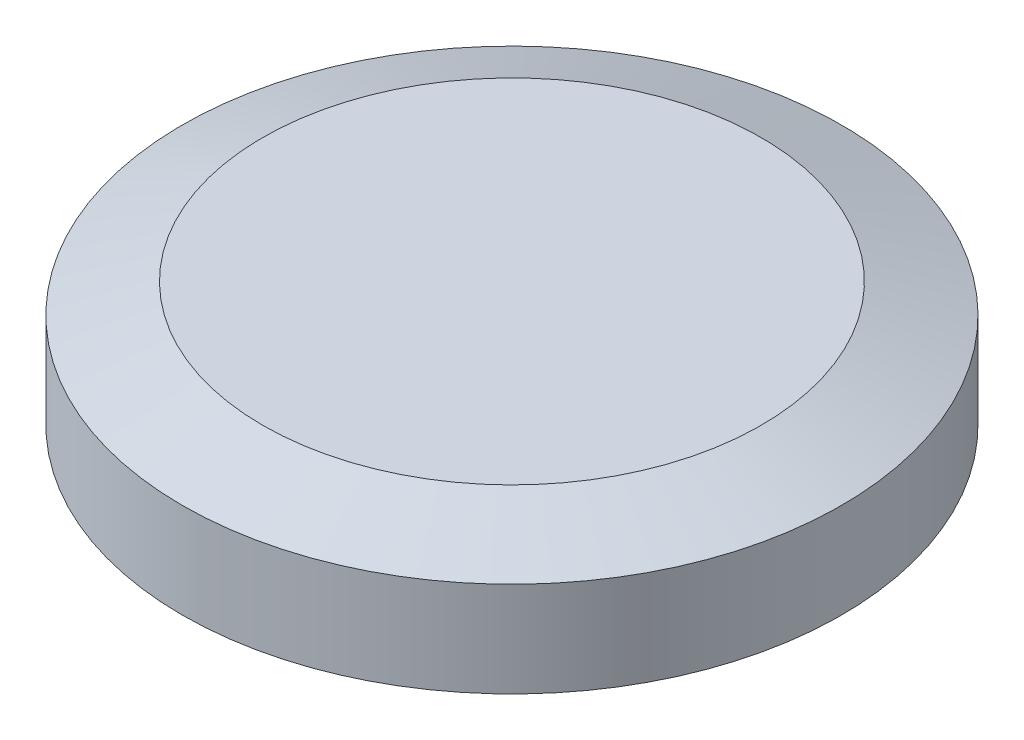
SolidWorks part; units mm, degrees
ref_plane "Front Plane" through (0, 0, 0) normal (0, 0, 1) x (1, 0, 0)
ref_plane "Top Plane" through (0, 0, 0) normal (0, 1, 0) x (1, 0, 0)
ref_plane "Right Plane" through (0, 0, 0) normal (1, 0, 0) x (0, 0, -1)
sketch "Sketch1" plane through (0, 0, 0) normal (0, 0, 1) x (1, 0, 0)
  line L0 (0, 0) -> (-8.2759, 0)
  line L1 (-8.8326, 0.2306) -> (-9.5843, 0.9823)
  line L2 (-10.922, 0.5726) -> (-10.922, -0.889)
  line L3 (-12.5984, -0.889) -> (-12.5984, 2.7432)
  line L4 (-12.5984, 2.7432) -> (-9.5278, 3.8608)
  line L5 (-9.5278, 3.8608) -> (0, 3.8608)
  line L6 (-12.5984, -0.889) -> (-10.922, -0.889)
  line L7 (0, 3.8608) -> (0, 0) construction
  line L8 (0, 0) -> (0, 3.8608)
  arc A0 (-10.922, 0.5726) -> (-9.5843, 0.9823) centre (-10.1473, 0.4318) cw
  arc A1 (-8.2759, 0) -> (-8.8326, 0.2306) centre (-8.2759, 0.7874) cw
  dimension "D1" = 0.7874
  dimension "D10" = 0.7874
  dimension "D2" = 0.889
  dimension "D3" = 4.7498
  dimension "D4" = 3.6322
  dimension "D5" = 12.5984
  dimension "D6" = 1.3208
  dimension "D7" = 10.922
  dimension "D8" = 10.1473
  dimension "D9" = 45
  dimension "D11" = 20
revolve "Revolve1" add sketch "Sketch1" angle 360 about L7
